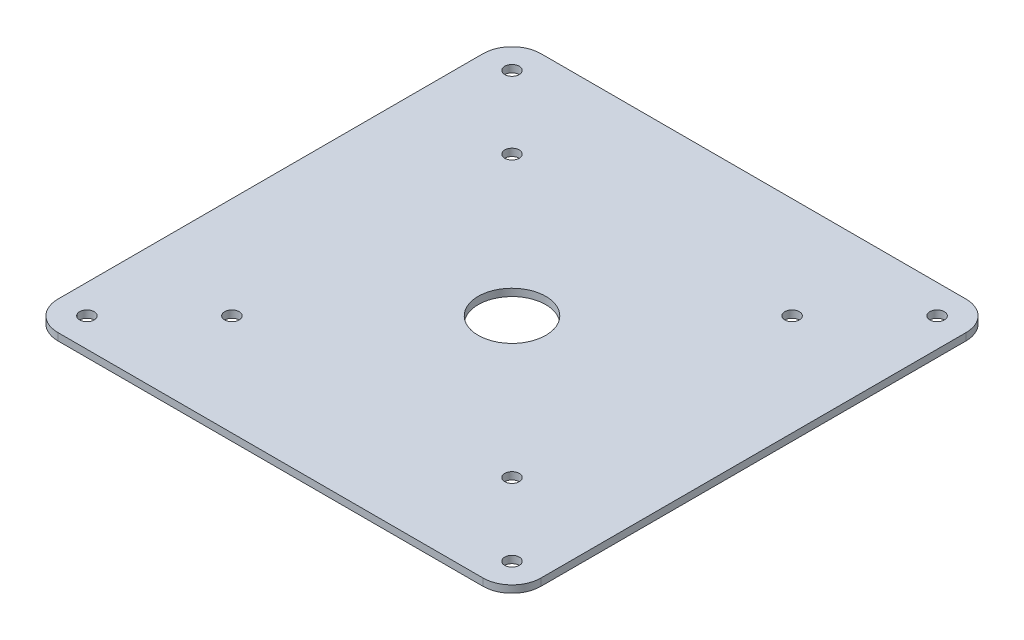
SolidWorks part; units mm, degrees
ref_plane "Front Plane" through (0, 0, 0) normal (0, 0, 1) x (1, 0, 0)
ref_plane "Top Plane" through (0, 0, 0) normal (0, 1, 0) x (1, 0, 0)
ref_plane "Right Plane" through (0, 0, 0) normal (1, 0, 0) x (0, 0, -1)
sketch "Sketch1" plane through (0, 0, 0) normal (0, 1, 0) x (1, 0, 0)
  line L1 (50, -50) -> (-50, -50)
  line L2 (50, -50) -> (50, 50)
  line L3 (50, 50) -> (-50, 50)
  line L4 (-50, -50) -> (-50, 50)
  line L5 (50, -50) -> (-50, 50) construction
  line L6 (50, 50) -> (-50, -50) construction
  line L7 (-28.9914, 28.9914) -> (28.9914, 28.9914) construction
  line L8 (-28.9914, 28.9914) -> (-28.9914, -28.9914) construction
  line L9 (-28.9914, -28.9914) -> (28.9914, -28.9914) construction
  line L10 (28.9914, 28.9914) -> (28.9914, -28.9914) construction
  circle A0 centre (-28.9914, 28.9914) radius 1.5
  circle A1 centre (28.9914, 28.9914) radius 1.5
  circle A2 centre (28.9914, -28.9914) radius 1.5
  circle A3 centre (-28.9914, -28.9914) radius 1.5
  point P0 (0, 0)
  dimension "D3" = 3
  dimension "D1" = 82
  dimension "D2" = 100
base flange "Base-Flange1" sketch "Sketch1" thickness 1.5 reverse thickness direction no parameters "D1"=1.5
fillet "Fillet1" radius 6 4 edges at (-50, -0.75, -50) (50, -0.75, -50) (50, -0.75, 50) (-50, -0.75, 50)
sketch "Sketch6" plane through (0, 0, 0) normal (0, 1, 0) x (1, 0, 0)
  line L0 (0, 0) -> (50, 0) construction
  line L1 (50, -44) -> (50, 44) construction
  circle A0 centre (-44, 44) radius 1.5
  circle A1 centre (44, 44) radius 1.5
  arc A2 (50, 44) -> (44, 50) centre (44, 44) ccw construction
  arc A3 (-44, 50) -> (-50, 44) centre (-44, 44) ccw construction
  circle A4 centre (44, -44) radius 1.5
  circle A5 centre (-44, -44) radius 1.5
  dimension "D1" = 3
extrude "Cut-Extrude1" cut sketch "Sketch6" against normal through all
sketch "Sketch7" plane through (0, 0, 0) normal (0, 1, 0) x (1, 0, 0)
  circle A0 centre (0, 0) radius 7
  dimension "D1" = 14
extrude "Cut-Extrude2" cut sketch "Sketch7" against normal through all
sketch "Bend-Lines1" [suppressed] plane through (0, 0, 0) normal (0, 1, 0) x (1, 0, 0)
sketch "Bounding-Box1" [suppressed] plane through (0, 0, 0) normal (0, 1, 0) x (1, 0, 0)
sheet metal parameters "Sheet-Metal1" thickness 1.5 parameters "D1"=1.5
flat pattern "Flat-Pattern1"
sketch "Bend-Lines2" plane through (0, 0, 0) normal (0, 1, 0) x (1, 0, 0)
sketch3d "Bounding-Box2" [suppressed]
  line L0 (-50, -50, 0) -> (50, -50, 0) construction
  line L1 (-50, 50, 0) -> (50, 50, 0) construction
  line L2 (-50, -50, 0) -> (-50, 50, 0) construction
  line L3 (50, -50, 0) -> (50, 50, 0) construction
sheet metal parameters "Sheet-Metal2" thickness 1.5 parameters "D1"=1.5
flat pattern "Flat-Pattern1"
sketch "Bend-Lines2" plane through (0, 0, 0) normal (0, 1, 0) x (1, 0, 0)
sketch3d "Bounding-Box2" [suppressed]
  line L0 (-50, -50, 0) -> (50, -50, 0) construction
  line L1 (-50, 50, 0) -> (50, 50, 0) construction
  line L2 (-50, -50, 0) -> (-50, 50, 0) construction
  line L3 (50, -50, 0) -> (50, 50, 0) construction
sheet metal parameters "Sheet-Metal3" thickness 1.5 parameters "D1"=1.5
flat pattern "Flat-Pattern1"
sketch "Bend-Lines2" plane through (0, 0, 0) normal (0, 1, 0) x (1, 0, 0)
sketch3d "Bounding-Box2" [suppressed]
  line L0 (-50, -50, 0) -> (50, -50, 0) construction
  line L1 (-50, 50, 0) -> (50, 50, 0) construction
  line L2 (-50, -50, 0) -> (-50, 50, 0) construction
  line L3 (50, -50, 0) -> (50, 50, 0) construction
